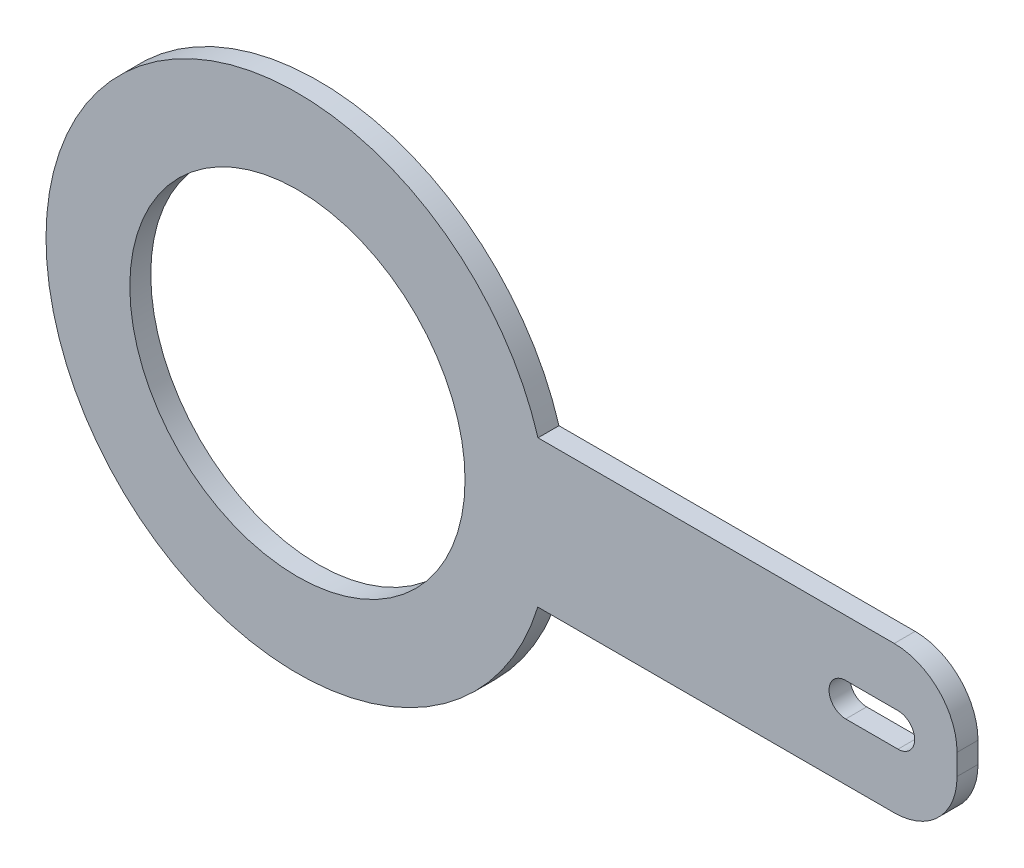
SolidWorks part; units mm, degrees
ref_plane "Front Plane" through (0, 0, 0) normal (0, 0, 1) x (1, 0, 0)
ref_plane "Top Plane" through (0, 0, 0) normal (0, 1, 0) x (1, 0, 0)
ref_plane "Right Plane" through (0, 0, 0) normal (1, 0, 0) x (0, 0, -1)
sketch "Sketch1" plane through (0, 0, 0) normal (0, 0, 1) x (1, 0, 0)
  line L0 (0, 0) -> (17.9123, 0) construction
  line L1 (5.7418, 1.7413) -> (14.2418, 1.7413)
  line L3 (5.7365, -1.7587) -> (14.2418, -1.7587)
  line L4 (15.7418, 0.2413) -> (15.7418, -0.2587)
  arc A0 (5.7418, 1.7413) -> (5.7365, -1.7587) centre (0, 0) ccw
  circle A1 centre (0, 0) radius 4
  arc A2 (14.2418, -1.7587) -> (15.7418, -0.2587) centre (14.2418, -0.2587) ccw
  arc A3 (14.2418, 1.7413) -> (15.7418, 0.2413) centre (14.2418, 0.2413) cw
  point P9 (15.7418, -1.7587)
  point P13 (15.7418, 1.7413)
  dimension "D1" = 12
  dimension "D2" = 8
  dimension "D5" = 1.5
  dimension "D3" = 3.5
  dimension "D4" = 10
extrude "Boss-Extrude1" add sketch "Sketch1" along normal blind 0.5
sketch "Sketch2" plane through (0, 0, 0.5) normal (0, 0, 1) x (1, 0, 0)
  line L0 (13.085, 0) -> (14.3322, 0) construction
  line L1 (13.085, 0.3978) -> (14.3322, 0.3978)
  line L2 (13.085, -0.3978) -> (14.3322, -0.3978)
  arc A0 (13.085, 0.3978) -> (13.085, -0.3978) centre (13.085, 0) ccw
  arc A1 (14.3322, -0.3978) -> (14.3322, 0.3978) centre (14.3322, 0) ccw
  point P3 (13.7086, 0)
extrude "Cut-Extrude1" cut sketch "Sketch2" against normal blind 0.5
